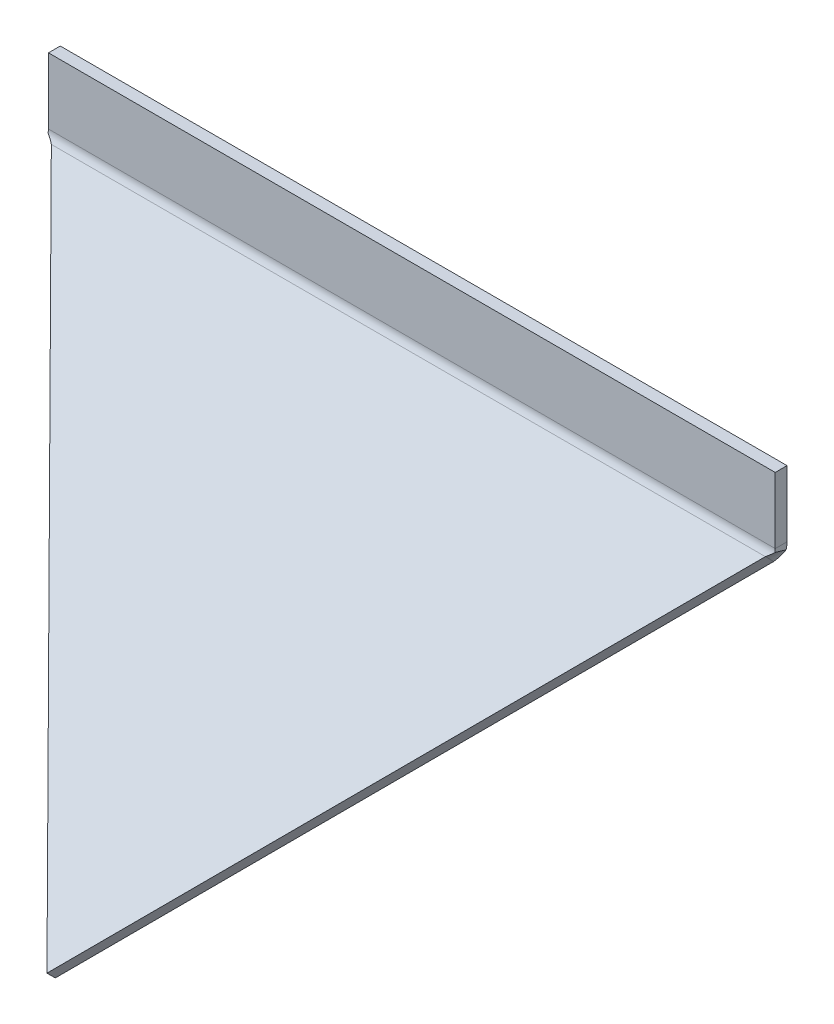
SolidWorks part; units mm, degrees
ref_plane "Front Plane" through (0, 0, 0) normal (0, 0, 1) x (1, 0, 0)
ref_plane "Top Plane" through (0, 0, 0) normal (0, 1, 0) x (1, 0, 0)
ref_plane "Right Plane" through (0, 0, 0) normal (1, 0, 0) x (0, 0, -1)
sketch "Sketch1" plane through (0, 0, 0) normal (0, 0, 1) x (1, 0, 0)
  line L0 (0, 0) -> (-390.5631, 556.8696)
  line L1 (0, 0) -> (390.5631, 556.8696)
  line L2 (390.5631, 556.8696) -> (390.5631, 633.0696)
  line L3 (390.5631, 633.0696) -> (-390.5631, 633.0696)
  line L4 (-390.5631, 633.0696) -> (-390.5631, 556.8696)
  line L5 (0, 0) -> (0, 633.0696) construction
  dimension "D1" = 781.1262
  dimension "D2" = 76.2
  dimension "D3" = 556.8696
sheet metal parameters "Sheet-Metal2" thickness 12.7 parameters "D1"=0.7366
base flange "Base-Flange2" sketch "Sketch1" thickness 12.7 reverse thickness direction yes parameters "D1"=0.7366
sketch "Sketch6" plane through (0, 0, 12.7) normal (0, 0, 1) x (1, 0, 0)
  line L0 (-390.5631, 556.8696) -> (390.5631, 556.8696)
sketched bend "Sketched Bend1" parameters "D1"=12.7
bend "SketchBend1" bend radius 12.7 bend angle 45.23 parameters "D5"=1
flat pattern "Flat-Pattern2"
sketch "Bend-Lines2" plane through (0, 0, 0) normal (0, 1, 0) x (-1, 0, 0)
bend of the flat pattern "Flatten-<SketchBend1>1"
